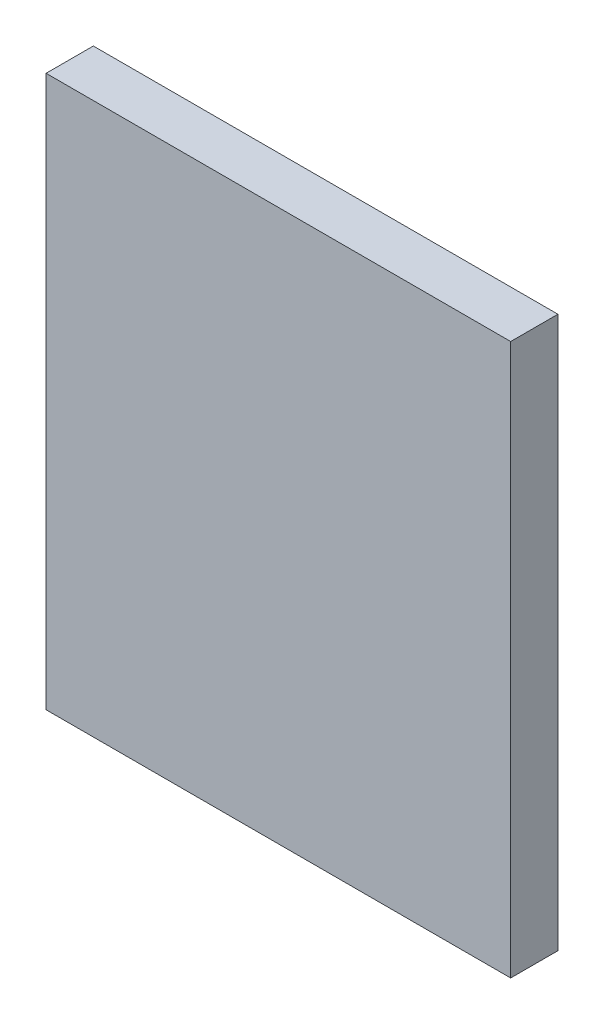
SolidWorks part; units mm, degrees
ref_plane "Plan de face" through (0, 0, 0) normal (0, 0, 1) x (1, 0, 0)
ref_plane "Plan de dessus" through (0, 0, 0) normal (0, 1, 0) x (1, 0, 0)
ref_plane "Plan de droite" through (0, 0, 0) normal (1, 0, 0) x (0, 0, -1)
sketch "Esquisse1" plane through (0, 0, 0) normal (0, 0, 1) x (1, 0, 0)
  line L1 (-14.75, 17.5) -> (14.75, 17.5)
  line L2 (-14.75, 17.5) -> (-14.75, -17.5)
  line L3 (-14.75, -17.5) -> (14.75, -17.5)
  line L4 (14.75, 17.5) -> (14.75, -17.5)
  line L5 (-14.75, 17.5) -> (14.75, -17.5) construction
  line L6 (-14.75, -17.5) -> (14.75, 17.5) construction
  point P0 (0, 0)
  dimension "D1" = 35
  dimension "D2" = 29.5
extrude "Boss.-Extru.1" add sketch "Esquisse1" along normal blind 3
